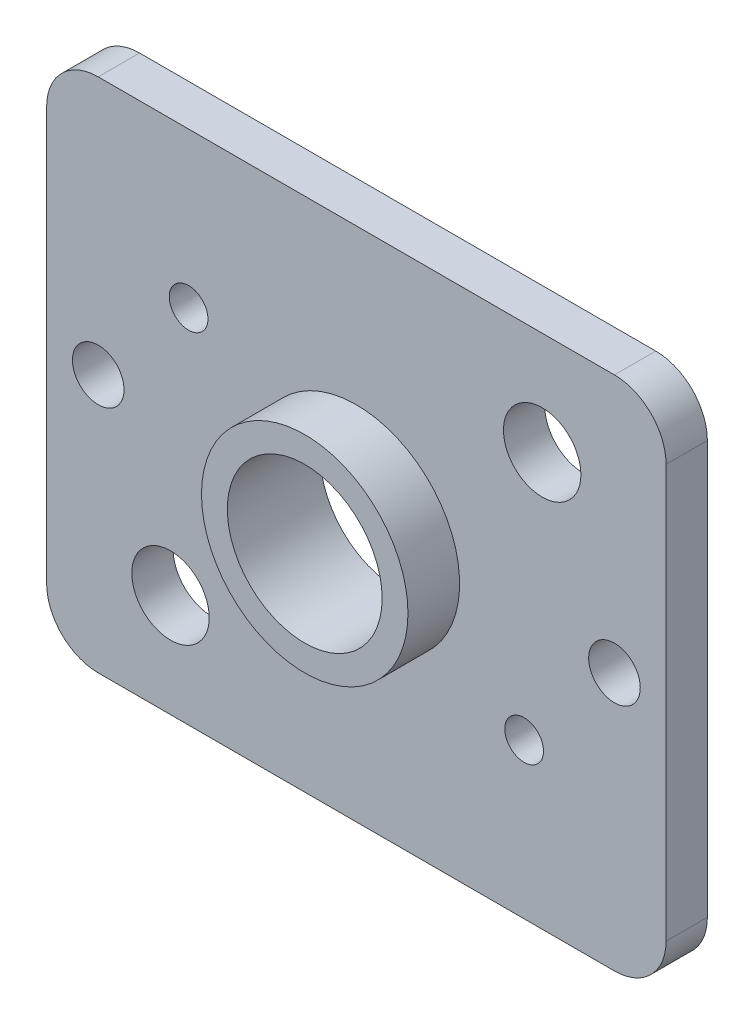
SolidWorks part; units mm, degrees
ref_plane "Спереди" through (0, 0, 0) normal (0, 0, 1) x (1, 0, 0)
ref_plane "Сверху" through (0, 0, 0) normal (0, 1, 0) x (1, 0, 0)
ref_plane "Справа" through (0, 0, 0) normal (1, 0, 0) x (0, 0, -1)
sketch "Эскиз1" plane through (0, 0, 0) normal (0, 0, 1) x (1, 0, 0)
  line L1 (-6, -5) -> (6, -5)
  line L2 (-6, -5) -> (-6, 5)
  line L3 (-6, 5) -> (6, 5)
  line L4 (6, -5) -> (6, 5)
  line L5 (-6, -5) -> (6, 5) construction
  line L6 (-6, 5) -> (6, -5) construction
  point P0 (0, 0)
  dimension "D1" = 12
  dimension "D2" = 10
extrude "Бобышка-Вытянуть1" add sketch "Эскиз1" along normal blind 0.8
sketch "Эскиз2" plane through (0, 0, 0.8) normal (0, 0, 1) x (1, 0, 0)
  line L0 (-6, -5) -> (6, 5) construction
  line L1 (-6, -5) -> (6, -5) construction
  line L2 (-6, 0) -> (6, 0) construction
  line L3 (-6, 5) -> (-6, -5) construction
  line L4 (6, 5) -> (-6, 5) construction
  line L5 (6, -5) -> (6, 5) construction
  circle A0 centre (0, 0) radius 1.5
  circle A1 centre (-3.6, -3) radius 0.75
  circle A2 centre (3.6, 3) radius 0.75
  circle A3 centre (3.25, -2) radius 0.375
  circle A4 centre (-3.25, 2) radius 0.375
  point P27 (0, 0)
  dimension "D1" = 3
  dimension "D3" = 1.5
  dimension "D5" = 1.5
  dimension "D8" = 0.75
  dimension "D9" = 2
  dimension "D2" = 2
  dimension "D4" = 2
  dimension "D6" = 2.75
  dimension "D7" = 3
extrude "Вырез-Вытянуть1" cut sketch "Эскиз2" against normal up to next
fillet "Скругление1" radius 1 4 edges at (6, -5, 0.4) (-6, -5, 0.4) (-6, 5, 0.4) (6, 5, 0.4)
sketch "Эскиз5" plane through (0, 0, 0.8) normal (0, 0, 1) x (1, 0, 0)
  line L1 (-6, 4) -> (-6, -4) construction
  line L3 (-6, 0) -> (6, 0) construction
  line L4 (6, -4) -> (6, 4) construction
  circle A0 centre (5, 0) radius 0.5
  circle A1 centre (-5, 0) radius 0.5
  dimension "D1" = 1
  dimension "D2" = 1
  dimension "D4" = 1
  dimension "D3" = 1
extrude "Вырез-Вытянуть2" cut sketch "Эскиз5" against normal through all
sketch "Эскиз14" plane through (0, 0, 0.8) normal (0, 0, 1) x (1, 0, 0)
  circle A0 centre (0, 0) radius 1.5 construction
  circle A1 centre (0, 0) radius 1.5
  circle A2 centre (0, 0) radius 2
  dimension "D1" = 0.5
extrude "Бобышка-Вытянуть2" add sketch "Эскиз14" along normal blind 1
